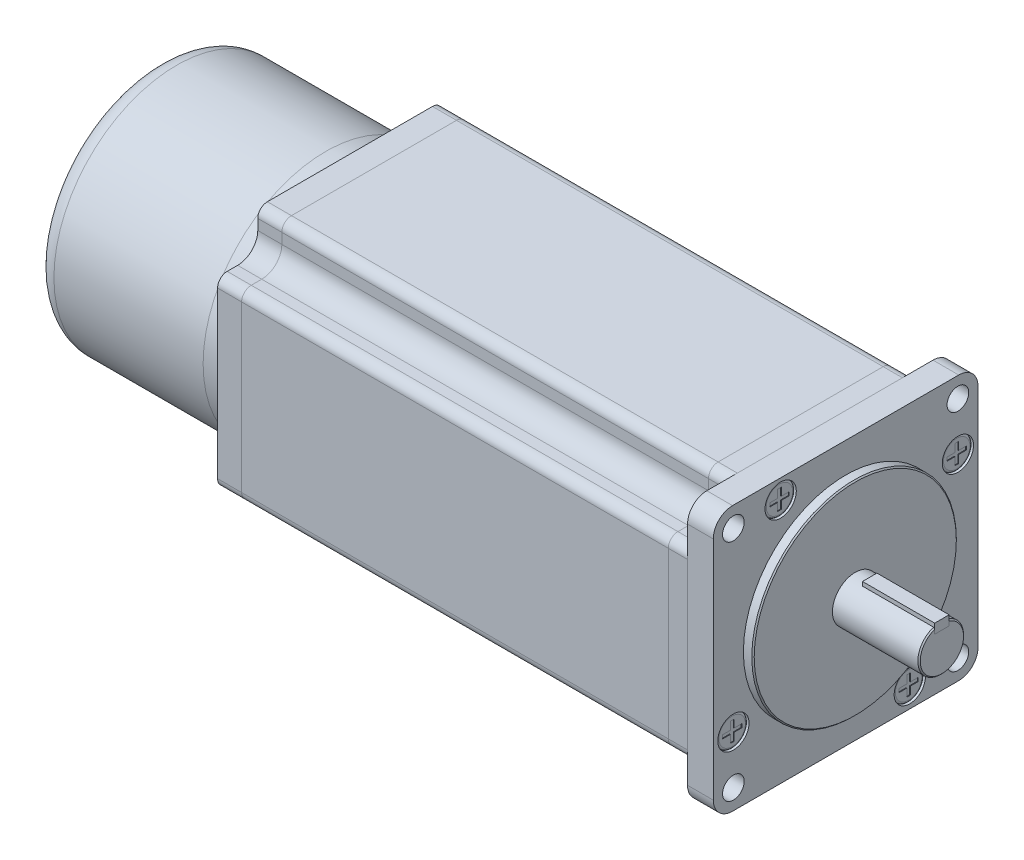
SolidWorks part; units mm, degrees
ref_plane "前视基准面" through (0, 0, 0) normal (0, 0, 1) x (1, 0, 0)
ref_plane "上视基准面" through (0, 0, 0) normal (0, 1, 0) x (1, 0, 0)
ref_plane "右视基准面" through (0, 0, 0) normal (1, 0, 0) x (0, 0, -1)
sketch "草图1" plane through (0, 0, 0) normal (1, 0, 0) x (0, 0, -1)
  line L1 (-47, -55) -> (47, -55)
  line L2 (-55, -47) -> (-55, 47)
  line L3 (-47, 55) -> (47, 55)
  line L4 (55, -47) -> (55, 47)
  line L5 (-55, -55) -> (55, 55) construction
  line L6 (-55, 55) -> (55, -55) construction
  arc A0 (-55, -47) -> (-47, -55) centre (-47, -47) ccw
  arc A1 (47, -55) -> (55, -47) centre (47, -47) ccw
  arc A2 (55, 47) -> (47, 55) centre (47, 47) ccw
  arc A3 (-55, 47) -> (-47, 55) centre (-47, 47) cw
  point P0 (0, 0)
  dimension "D1" = 8
extrude "凸台-拉伸1" add sketch "草图1" against normal blind 10.7
sketch "草图2" plane through (-10.7, 0, 0) normal (-1, 0, 0) x (0, 0, 1)
  line L0 (-55, -47) -> (-55, 47) construction
  line L1 (47, -55) -> (-47, -55)
  line L2 (55, -47) -> (55, 47)
  line L3 (47, 55) -> (-47, 55)
  line L4 (-55, -47) -> (-55, 47)
  line L5 (55, -55) -> (-55, 55) construction
  line L6 (55, 55) -> (-55, -55) construction
  arc A0 (47, -55) -> (55, -47) centre (47, -47) ccw
  arc A1 (55, 47) -> (47, 55) centre (47, 47) ccw
  arc A2 (-47, 55) -> (-55, 47) centre (-47, 47) ccw
  arc A3 (-47, -55) -> (-55, -47) centre (-47, -47) cw
  point P0 (0, 0)
  dimension "D1" = 8
extrude "凸台-拉伸2" add sketch "草图2" along normal blind 8 separate body
sketch "草图3" plane through (-18.7, 0, 0) normal (-1, 0, 0) x (0, 0, 1)
  line L0 (-55, 47) -> (-55, -47) construction
  line L1 (47, -55) -> (-47, -55)
  line L2 (55, -47) -> (55, 47)
  line L3 (47, 55) -> (-47, 55)
  line L4 (-55, -47) -> (-55, 47)
  line L5 (55, -55) -> (-55, 55) construction
  line L6 (55, 55) -> (-55, -55) construction
  arc A0 (47, -55) -> (55, -47) centre (47, -47) ccw
  arc A1 (55, 47) -> (47, 55) centre (47, 47) ccw
  arc A2 (-47, 55) -> (-55, 47) centre (-47, 47) ccw
  arc A3 (-47, -55) -> (-55, -47) centre (-47, -47) cw
  point P0 (0, 0)
  dimension "D1" = 8
extrude "凸台-拉伸3" add sketch "草图3" along normal blind 177.3 separate body
sketch "草图4" plane through (-196, 0, 0) normal (-1, 0, 0) x (0, 0, 1)
  line L0 (-46.65, -38.3) -> (-51, -38.3)
  line L1 (46.65, -38.3) -> (51, -38.3)
  line L2 (-47, -55) -> (-34.3, -55)
  line L3 (38.3, -46.65) -> (38.3, -51)
  line L5 (-55, -47) -> (-55, -34.3)
  line L6 (-55, 34.2927) -> (-55, 47)
  line L9 (-38.3, -46.65) -> (-38.3, -51)
  line L11 (-47, 55) -> (-34.2927, 55)
  line L12 (34.2927, 55) -> (47, 55)
  line L14 (55, 47) -> (55, 34.2927)
  line L15 (55, -34.3) -> (55, -47)
  line L17 (46.65, 38.2927) -> (51, 38.2927)
  line L19 (47, -55) -> (34.3, -55)
  line L20 (38.2927, 46.65) -> (38.2927, 51)
  line L23 (-38.2927, 46.65) -> (-38.2927, 51)
  line L25 (-46.65, 38.2927) -> (-51, 38.2927)
  arc A0 (-38.3, -46.65) -> (-46.65, -38.3) centre (-46.65, -46.65) ccw
  arc A1 (-46.65, 38.2927) -> (-38.2927, 46.65) centre (-46.65, 46.65) ccw
  arc A2 (38.2927, 46.65) -> (46.65, 38.2927) centre (46.65, 46.65) ccw
  arc A3 (46.65, -38.3) -> (38.3, -46.65) centre (46.65, -46.65) ccw
  arc A4 (-55, -47) -> (-47, -55) centre (-47, -47) ccw
  arc A5 (-47, 55) -> (-55, 47) centre (-47, 47) ccw
  arc A6 (55, 47) -> (47, 55) centre (47, 47) ccw
  arc A7 (47, -55) -> (55, -47) centre (47, -47) ccw
  arc A8 (38.3, -51) -> (34.3, -55) centre (34.3, -51) cw
  arc A9 (51, -38.3) -> (55, -34.3) centre (51, -34.3) ccw
  arc A10 (55, 34.2927) -> (51, 38.2927) centre (51, 34.2927) ccw
  arc A11 (38.2927, 51) -> (34.2927, 55) centre (34.2927, 51) ccw
  arc A12 (-34.2927, 55) -> (-38.2927, 51) centre (-34.2927, 51) ccw
  arc A13 (-51, 38.2927) -> (-55, 34.2927) centre (-51, 34.2927) ccw
  arc A14 (-51, -38.3) -> (-55, -34.3) centre (-51, -34.3) cw
  arc A15 (-34.3, -55) -> (-38.3, -51) centre (-34.3, -51) cw
  point P0 (0, 0)
  dimension "D1" = 4
  dimension "D2" = 4
extrude "切除-拉伸1" cut sketch "草图4" against normal blind 195.3
sketch "草图6" plane through (0, 0, 0) normal (1, 0, 0) x (0, 0, -1)
  circle A0 centre (0, 0) radius 42.5
extrude "凸台-拉伸5" add sketch "草图6" along normal blind 4
chamfer "倒角1" distance 0.5 angle 45 1 edges at (4, 0, -42.5)
sketch "草图7" plane through (4, 0, 0) normal (1, 0, 0) x (0, 0, -1)
  circle A0 centre (0, 0) radius 9.5
extrude "凸台-拉伸6" add sketch "草图7" along normal blind 36
chamfer "倒角2" distance 0.5 angle 45 1 edges at (40, 0, -9.5)
sketch "草图8" plane through (40, 0, 0) normal (1, 0, 0) x (0, 0, -1)
  line L3 (-3, 6.7) -> (-3, 9.0139)
  line L5 (3, 9.0139) -> (3, 6.7)
  line L6 (-3, 6.7) -> (3, 6.7)
  arc A0 (3, 9.0139) -> (-3, 9.0139) centre (0, 0) ccw
sketch "草图10" plane through (0, 0, 0) normal (1, 0, 0) x (0, 0, -1)
  line L1 (-46.65, -46.65) -> (46.65, -46.65)
  line L2 (-46.65, -46.65) -> (-46.65, 46.65)
  line L3 (-46.65, 46.65) -> (46.65, 46.65)
  line L4 (46.65, -46.65) -> (46.65, 46.65)
  line L5 (-46.65, -46.65) -> (46.65, 46.65) construction
  line L6 (-46.65, 46.65) -> (46.65, -46.65) construction
  circle A0 centre (46.65, 46.65) radius 4.5
  circle A1 centre (46.65, -46.65) radius 4.5
  circle A2 centre (-46.65, -46.65) radius 4.5
  circle A3 centre (-46.65, 46.65) radius 4.5
  point P0 (0, 0)
extrude "切除-拉伸3" cut sketch "草图10" against normal blind 10.7 contours L3 A3 L2 | L2 A3 L3 | L4 A0 L3 | L3 A0 L4 | L1 A1 L4 | L4 A1 L1 | L2 A2 L1 | L1 A2 L2
sketch "草图11" plane through (0, 0, 0) normal (1, 0, 0) x (0, 0, -1)
  circle A0 centre (-27, 47) radius 6.5
  circle A1 centre (46.65, 26.65) radius 6.5
  circle A2 centre (26.65, -46.65) radius 6.5
  circle A3 centre (-46.65, -26.65) radius 6.5
extrude "切除-拉伸4" cut sketch "草图11" against normal blind 1.5
sketch "草图12" plane through (-1.5, 0, 0) normal (1, 0, 0) x (0, 0, -1)
  circle A0 centre (-27, 47) radius 6.5
  circle A1 centre (46.65, 26.65) radius 6.5
  circle A2 centre (26.65, -46.65) radius 6.5
  circle A3 centre (-46.65, -26.65) radius 6.5
extrude "凸台-拉伸8" add sketch "草图12" along normal blind 1 separate body
fillet "圆角2" radius 1 1 edges at (-0.5, 47, 20.5)
fillet "圆角3" radius 1 1 edges at (-0.5, 26.65, -53.15)
fillet "圆角4" radius 1 1 edges at (-0.5, -26.65, 40.15)
fillet "圆角5" radius 1 1 edges at (-0.5, -46.65, -33.15)
sketch "草图13" plane through (-0.5, 0, 0) normal (1, 0, 0) x (0, 0, -1)
  line L0 (45.9, 25.9) -> (45.9, 22.65)
  line L1 (-27.75, 51) -> (-26.25, 51)
  line L2 (-27.75, 51) -> (-27.75, 47.75)
  line L3 (-27.75, 43) -> (-26.25, 43)
  line L4 (-26.25, 51) -> (-26.25, 47.75)
  line L5 (-47.4, -27.4) -> (-47.4, -30.65)
  line L6 (-47.4, -27.4) -> (-50.65, -27.4)
  line L7 (-23, 47.75) -> (-26.25, 47.75)
  line L8 (-23, 47.75) -> (-23, 46.25)
  line L9 (-23, 46.25) -> (-26.25, 46.25)
  line L10 (-31, 47.75) -> (-31, 46.25)
  line L11 (25.9, -45.9) -> (22.65, -45.9)
  line L12 (-47.4, -25.9) -> (-50.65, -25.9)
  line L13 (45.9, 30.65) -> (47.4, 30.65)
  line L14 (45.9, 30.65) -> (45.9, 27.4)
  line L15 (45.9, 22.65) -> (47.4, 22.65)
  line L16 (47.4, 30.65) -> (47.4, 27.4)
  line L17 (-27.75, 46.25) -> (-27.75, 43)
  line L18 (-45.9, -27.4) -> (-45.9, -30.65)
  line L19 (50.65, 27.4) -> (47.4, 27.4)
  line L20 (50.65, 27.4) -> (50.65, 25.9)
  line L21 (50.65, 25.9) -> (47.4, 25.9)
  line L22 (42.65, 27.4) -> (42.65, 25.9)
  line L25 (25.9, -42.65) -> (27.4, -42.65)
  line L26 (25.9, -42.65) -> (25.9, -45.9)
  line L27 (25.9, -50.65) -> (27.4, -50.65)
  line L28 (27.4, -42.65) -> (27.4, -45.9)
  line L31 (30.65, -45.9) -> (27.4, -45.9)
  line L32 (30.65, -45.9) -> (30.65, -47.4)
  line L33 (30.65, -47.4) -> (27.4, -47.4)
  line L34 (22.65, -45.9) -> (22.65, -47.4)
  line L37 (-47.4, -22.65) -> (-45.9, -22.65)
  line L38 (-47.4, -22.65) -> (-47.4, -25.9)
  line L39 (-47.4, -30.65) -> (-45.9, -30.65)
  line L40 (-45.9, -22.65) -> (-45.9, -25.9)
  line L41 (27.4, -47.4) -> (27.4, -50.65)
  line L43 (-42.65, -25.9) -> (-45.9, -25.9)
  line L44 (-42.65, -25.9) -> (-42.65, -27.4)
  line L45 (-42.65, -27.4) -> (-45.9, -27.4)
  line L46 (-50.65, -25.9) -> (-50.65, -27.4)
  line L48 (25.9, -47.4) -> (22.65, -47.4)
  line L49 (25.9, -47.4) -> (25.9, -50.65)
  line L50 (-27.75, 46.25) -> (-31, 46.25)
  line L51 (-26.25, 46.25) -> (-26.25, 43)
  line L52 (-27.75, 47.75) -> (-31, 47.75)
  line L53 (45.9, 25.9) -> (42.65, 25.9)
  line L54 (47.4, 25.9) -> (47.4, 22.65)
  line L55 (45.9, 27.4) -> (42.65, 27.4)
  point P0 (-27, 47)
  point P6 (-27, 47)
  point P11 (46.65, 26.65)
  point P17 (46.65, 26.65)
  point P22 (26.65, -46.65)
  point P28 (26.65, -46.65)
  point P33 (-46.65, -26.65)
  point P39 (-46.65, -26.65)
extrude "切除-拉伸5" cut sketch "草图13" against normal blind 0.3
sketch "草图14" plane through (-196, 0, 0) normal (-1, 0, 0) x (0, 0, 1)
  line L0 (-51, -38.3) -> (-46.3, -38.3073)
  line L1 (-34.3, -55) -> (34.3, -55)
  line L4 (55, -34.3) -> (55, 34.2927)
  line L6 (-55, -34.3) -> (-55, 34.2927)
  line L7 (-38.3, -46.65) -> (-38.3, -51)
  line L8 (-34.3, -55) -> (34.3, -55)
  line L10 (38.3, -51) -> (38.3, -46.65)
  line L12 (46.65, -38.3) -> (51, -38.3)
  line L14 (55, -34.3) -> (55, 34.2927)
  line L16 (51, 38.2927) -> (46.65, 38.2927)
  line L18 (38.2927, 46.65) -> (38.2927, 51)
  line L19 (34.2927, 55) -> (-34.2927, 55)
  line L21 (-38.2927, 51) -> (-38.2927, 46.65)
  line L23 (-46.65, 38.2927) -> (-51, 38.2927)
  line L25 (-34.2927, 55) -> (34.2927, 55)
  line L27 (55, 46.3) -> (55, 47)
  arc A0 (-38.3, -46.65) -> (-46.9739, -38.3063) centre (-46.65, -46.65) ccw
  arc A2 (38.2927, 46.65) -> (46.65, 38.2927) centre (46.65, 46.65) ccw
  arc A3 (46.65, -38.3) -> (38.3, -46.65) centre (46.65, -46.65) ccw
  arc A4 (34.3, -55) -> (38.3, -51) centre (34.3, -51) ccw
  arc A5 (51, -38.3) -> (55, -34.3) centre (51, -34.3) ccw
  arc A6 (55, 34.2927) -> (51, 38.2927) centre (51, 34.2927) ccw
  arc A7 (38.2927, 51) -> (34.2927, 55) centre (34.2927, 51) ccw
  arc A8 (-34.2927, 55) -> (-38.2927, 51) centre (-34.2927, 51) ccw
  arc A9 (-51, 38.2927) -> (-55, 34.2927) centre (-51, 34.2927) ccw
  arc A10 (-55, -34.3) -> (-51, -38.3) centre (-51, -34.3) ccw
  arc A11 (-38.3, -51) -> (-34.3, -55) centre (-34.3, -51) ccw
  arc A12 (38.2927, 51) -> (34.2927, 55) centre (34.2927, 51) ccw
  arc A13 (-46.65, 38.2927) -> (-38.2927, 46.65) centre (-46.65, 46.65) ccw
  arc A16 (55, 46.3) -> (55, 47) centre (46.65, 46.65) ccw
  point P0 (0, 0)
extrude "凸台-拉伸10" add sketch "草图14" along normal blind 10 separate body
sketch "草图15" plane through (-206, 0, 0) normal (-1, 0, 0) x (0, 0, 1)
  circle A0 centre (0, 0) radius 51
extrude "凸台-拉伸11" add sketch "草图15" along normal blind 10
extrude "切除-拉伸6" cut sketch "草图8" against normal blind 30
sketch "草图16" plane through (0, 6.7, 0) normal (0, 1, 0) x (1, 0, 0)
  line L0 (40, -3) -> (40, 3)
  line L1 (40, 3) -> (10, 3)
  line L2 (10, 3) -> (10, -3)
  line L3 (10, -3) -> (40, -3)
extrude "凸台-拉伸12" add sketch "草图16" along normal blind 4 separate body
sketch "草图17" plane through (-216, 0, 0) normal (-1, 0, 0) x (0, 0, 1)
  circle A0 centre (0, 0) radius 51
extrude "凸台-拉伸13" add sketch "草图17" along normal blind 70 separate body
fillet "圆角6" radius 8 1 edges at (-286, 0, 51)
